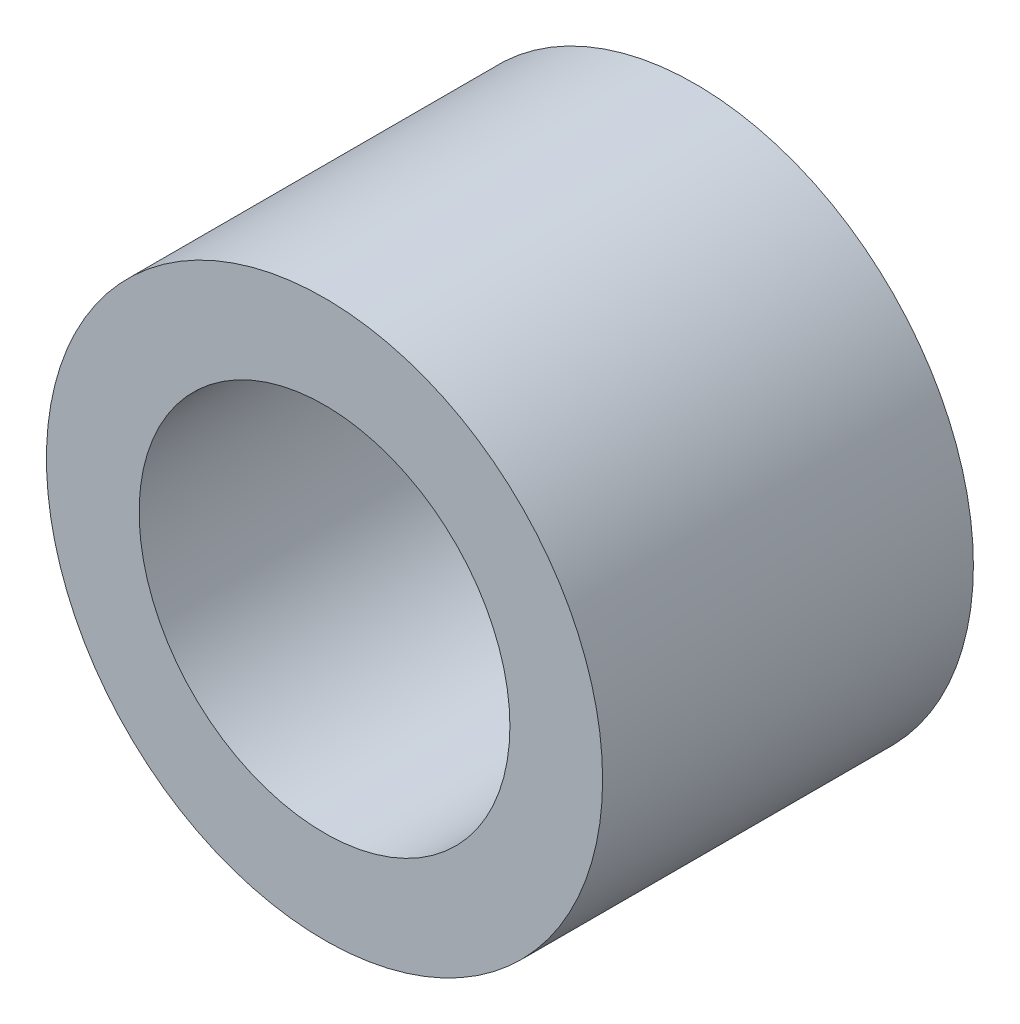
SolidWorks part; units mm, degrees
ref_plane "Front Plane" through (0, 0, 0) normal (0, 0, 1) x (1, 0, 0)
ref_plane "Top Plane" through (0, 0, 0) normal (0, 1, 0) x (1, 0, 0)
ref_plane "Right Plane" through (0, 0, 0) normal (1, 0, 0) x (0, 0, -1)
sketch "Sketch1" plane through (0, 0, 0) normal (0, 0, 1) x (1, 0, 0)
  circle A0 centre (0, 0) radius 3
  dimension "D1" = 6
extrude "Boss-Extrude1" add sketch "Sketch1" along normal blind 4
sketch "Sketch2" plane through (0, 0, 4) normal (0, 0, 1) x (1, 0, 0)
  circle A0 centre (0, 0) radius 2
  dimension "D1" = 4
extrude "Cut-Extrude1" cut sketch "Sketch2" against normal through all
